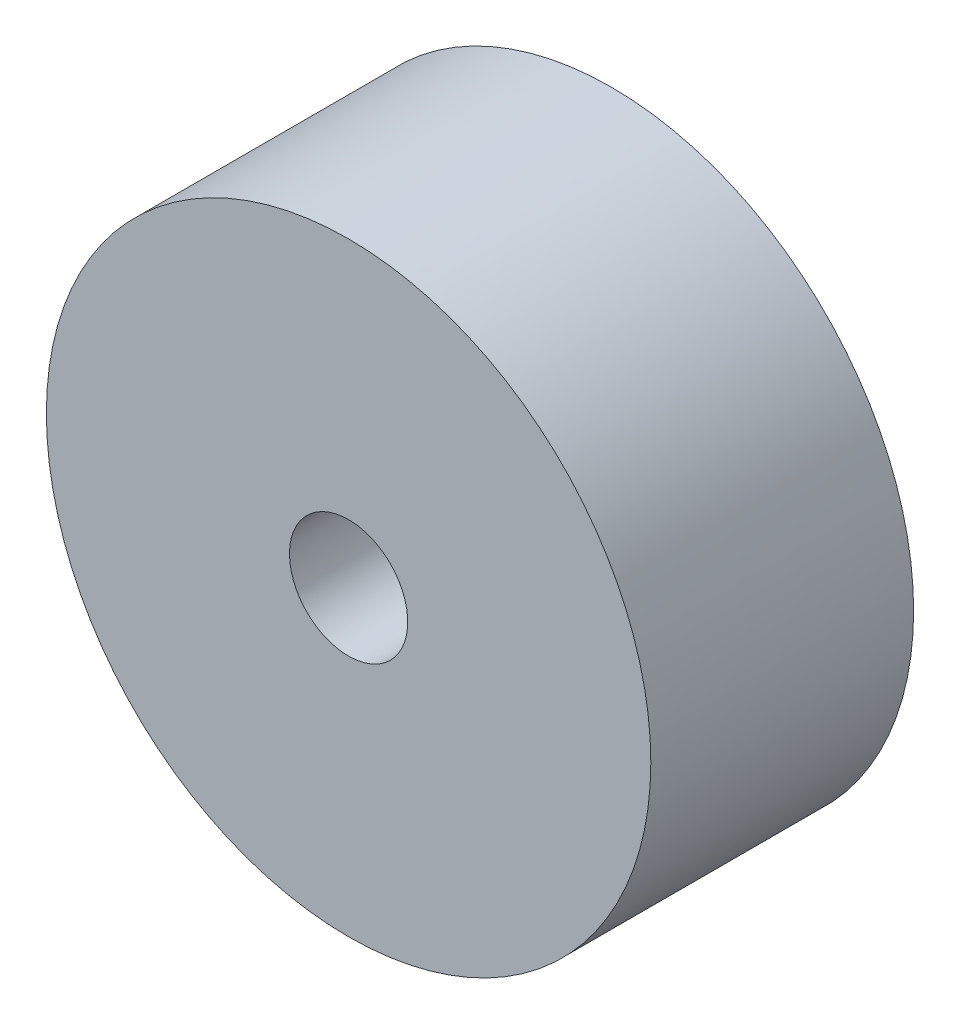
SolidWorks part; units mm, degrees
ref_plane "Front Plane" through (0, 0, 0) normal (0, 0, 1) x (1, 0, 0)
ref_plane "Top Plane" through (0, 0, 0) normal (0, 1, 0) x (1, 0, 0)
ref_plane "Right Plane" through (0, 0, 0) normal (1, 0, 0) x (0, 0, -1)
sketch "Sketch1" plane through (0, 0, 0) normal (0, 0, 1) x (1, 0, 0)
  circle A0 centre (0, 0) radius 11.5
  dimension "D1" = 23
extrude "Boss-Extrude1" add sketch "Sketch1" along normal blind 10
sketch "Sketch2" plane through (0, 0, 0) normal (0, 0, -1) x (-1, 0, 0)
  circle A0 centre (0, 0) radius 8.5
  dimension "D1" = 17
extrude "Cut-Extrude1" cut sketch "Sketch2" against normal blind 5
sketch "Sketch3" plane through (0, 0, 5) normal (0, 0, -1) x (-1, 0, 0)
  circle A0 centre (0, 0) radius 2.25
  dimension "D1" = 4.5
extrude "Cut-Extrude2" cut sketch "Sketch3" against normal through all
